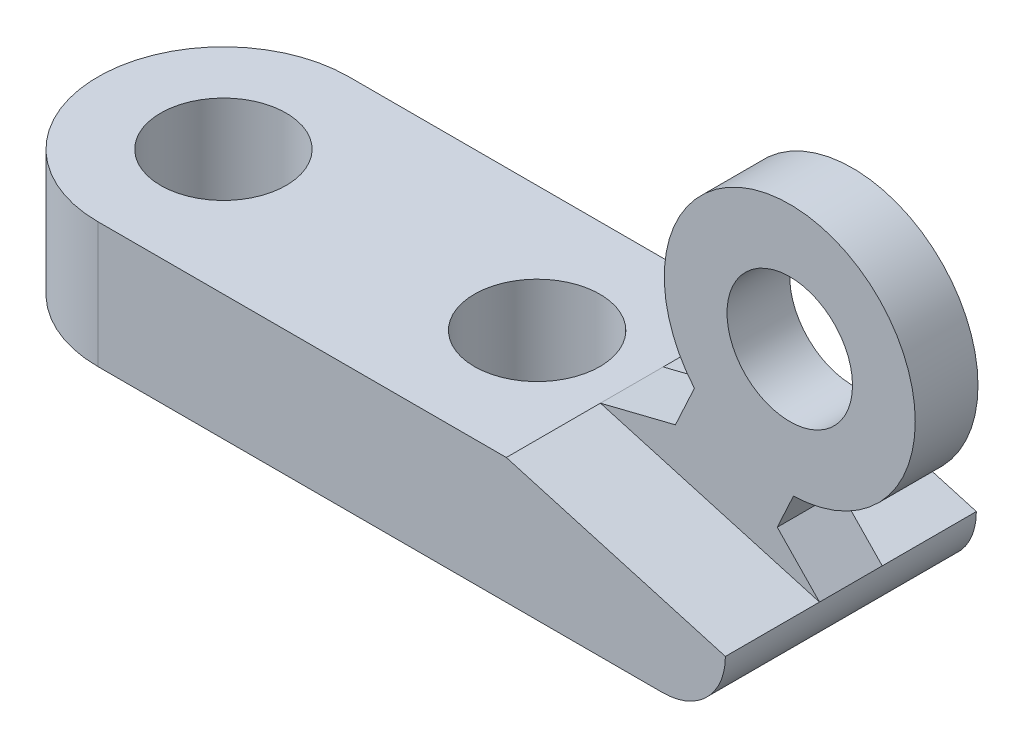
SolidWorks part; units mm, degrees
ref_plane "Front Plane" through (0, 0, 0) normal (0, 0, 1) x (1, 0, 0)
ref_plane "Top Plane" through (0, 0, 0) normal (0, 1, 0) x (1, 0, 0)
ref_plane "Right Plane" through (0, 0, 0) normal (1, 0, 0) x (0, 0, -1)
sketch "Sketch1" plane through (0, 0, 0) normal (0, 1, 0) x (1, 0, 0)
  line L0 (0, 1) -> (5, 1)
  line L1 (0, -1) -> (5, -1)
  line L2 (5, -1) -> (5, 1)
  circle A0 centre (0, 0) radius 1
  circle A1 centre (0, 0) radius 0.5
  circle A2 centre (2.5, 0) radius 0.5
  point P10 (0, 0)
  dimension "D1" = 2
  dimension "D3" = 1
  dimension "D2" = 5
  dimension "D4" = 2.5
extrude "Boss-Extrude1" add sketch "Sketch1" along normal blind 1 contours A0 L1 L2 L0 A2 | A0 A1
fillet "Fillet1" radius 0.5 1 edges at (5, 0, 0)
sketch "Sketch2" plane through (0, 0, 1) normal (0, 0, 1) x (1, 0, 0)
  line L0 (5, 0.5) -> (3.2544, 1)
  line L2 (0, 1) -> (5, 1) construction
  line L3 (5, 0.5) -> (5, 1)
  line L4 (5, 1) -> (3.2544, 1)
  arc A0 (4.5, 0) -> (5, 0.5) centre (4.5, 0.5) ccw construction
  point P2 (5, 0.4553)
  point P3 (5, 0.5)
  point P6 (4.567, 1)
  point P9 (4.3442, 1)
  point P10 (3.2544, 1)
  point P11 (5, 0.75)
extrude "Cut-Extrude1" cut sketch "Sketch2" against normal up to surface (2 mm away)
sketch "Sketch3" plane through (0, 0, 1) normal (0, 0, 1) x (1, 0, 0)
  line L0 (3.8518, 1.1492) -> (4.0032, 1.4771)
  line L1 (4.6634, 0.8484) -> (4.7924, 1.1277)
  line L2 (3.2544, 1) -> (5, 0.5) construction
  line L3 (4.763, 2.1273) -> (4.1272, 0.75) construction
  line L4 (3.8518, 1.1492) -> (3.2544, 1)
  line L5 (5, 0.5) -> (4.6634, 0.8484)
  line L6 (5, 0.5) -> (3.2544, 1)
  line L7 (3.8518, 1.1492) -> (4.6634, 0.8484) construction
  circle A0 centre (4.763, 2.1273) radius 1
  circle A1 centre (4.763, 2.1273) radius 0.5
  point P2 (4.6742, 0.8063)
  point P8 (4.517, 0.8094)
  point P13 (4.6836, 0.822)
  point P14 (4.6585, 0.8377)
  dimension "D1" = 2
  dimension "D4" = 1
  dimension "D2" = 30
  dimension "D3" = 30
extrude "Boss-Extrude2" add sketch "Sketch3" against normal blind 0.5 from offset 0.75 separate body
